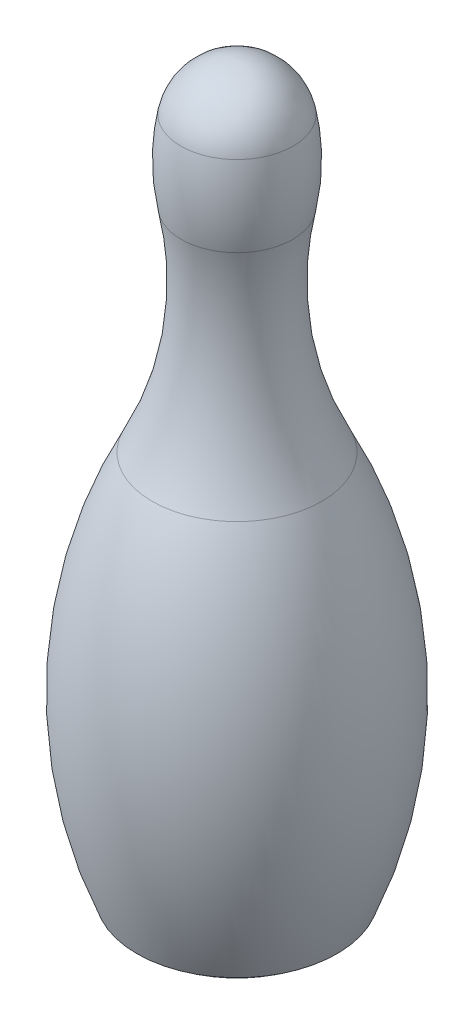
SolidWorks part; units mm, degrees
ref_plane "Plan de face" through (0, 0, 0) normal (0, 0, 1) x (1, 0, 0)
ref_plane "Plan de dessus" through (0, 0, 0) normal (0, 1, 0) x (1, 0, 0)
ref_plane "Plan de droite" through (0, 0, 0) normal (1, 0, 0) x (0, 0, -1)
sketch "Esquisse1" plane through (0, 0, 0) normal (0, 0, 1) x (1, 0, 0)
  line L0 (0, 0) -> (0, 38)
  line L1 (0, 0) -> (5, 0)
  line L2 (0, 38) -> (5.6772, 38) construction
  line L3 (7, 0) -> (7, 13.4801) construction
  arc A0 (0, 38) -> (2.9087, 35.6025) centre (0, 35.0368) cw
  arc A1 (5, 0) -> (4.4041, 20.3889) centre (-16.8675, 9.564) ccw
  arc A2 (2.9087, 35.6025) -> (2.8953, 31.4059) centre (-7.7044, 33.5383) cw
  arc A3 (2.8953, 31.4059) -> (4.4041, 20.3889) centre (19.4921, 28.067) ccw
  dimension "D1" = 38
  dimension "D2" = 5
  dimension "D3" = 7
revolve "Révolution1" add sketch "Esquisse1" angle 360 about L0
chamfer "Chanfrein1" distance 0.5 angle 30 1 edges at (0, 0, -5)
